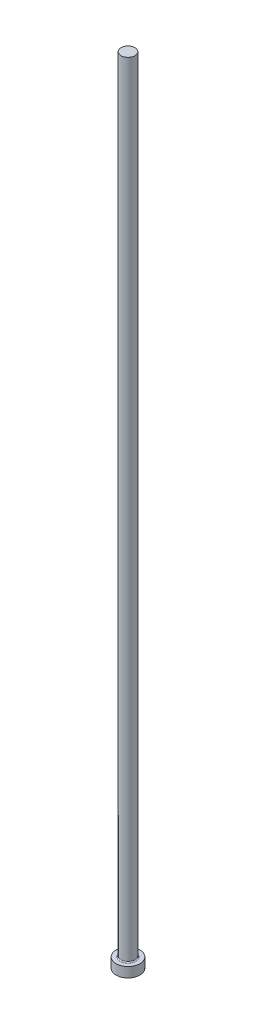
SolidWorks part; units mm, degrees
ref_plane "Plano frontal" through (0, 0, 0) normal (0, 0, 1) x (1, 0, 0)
ref_plane "Plano superior" through (0, 0, 0) normal (0, 1, 0) x (1, 0, 0)
ref_plane "Plano direito" through (0, 0, 0) normal (1, 0, 0) x (0, 0, -1)
sketch "Esboço1" plane through (0, 0, 0) normal (0, 0, 1) x (1, 0, 0)
  line L0 (0, 0) -> (6, 0)
  line L1 (6, 0) -> (6, 5)
  line L2 (6, 5) -> (4, 5)
  line L3 (3.5, 5.5) -> (3.5, 400)
  line L4 (3.5, 400) -> (0, 400)
  line L5 (0, 400) -> (0, 0) construction
  line L6 (0, 0) -> (0, 400)
  arc A0 (4, 5) -> (3.5, 5.5) centre (4, 5.5) cw
  dimension "D3" = 0.5
  dimension "D1" = 12
  dimension "D2" = 7
  dimension "D4" = 5
  dimension "D5" = 400
revolve "Revolução1" add sketch "Esboço1" angle 360 about L5
sketch "Esboço2"
  dimension "D1" = 1.05
  dimension "D2" = 0.675
  dimension "D3" = 3.225
  dimension "D4" = 0.45
wrap "Envolver1" sketch "Esboço2" wrap type deboss source sketch "Esboço2" thickness 0.1 parameters "D1"=0.1
